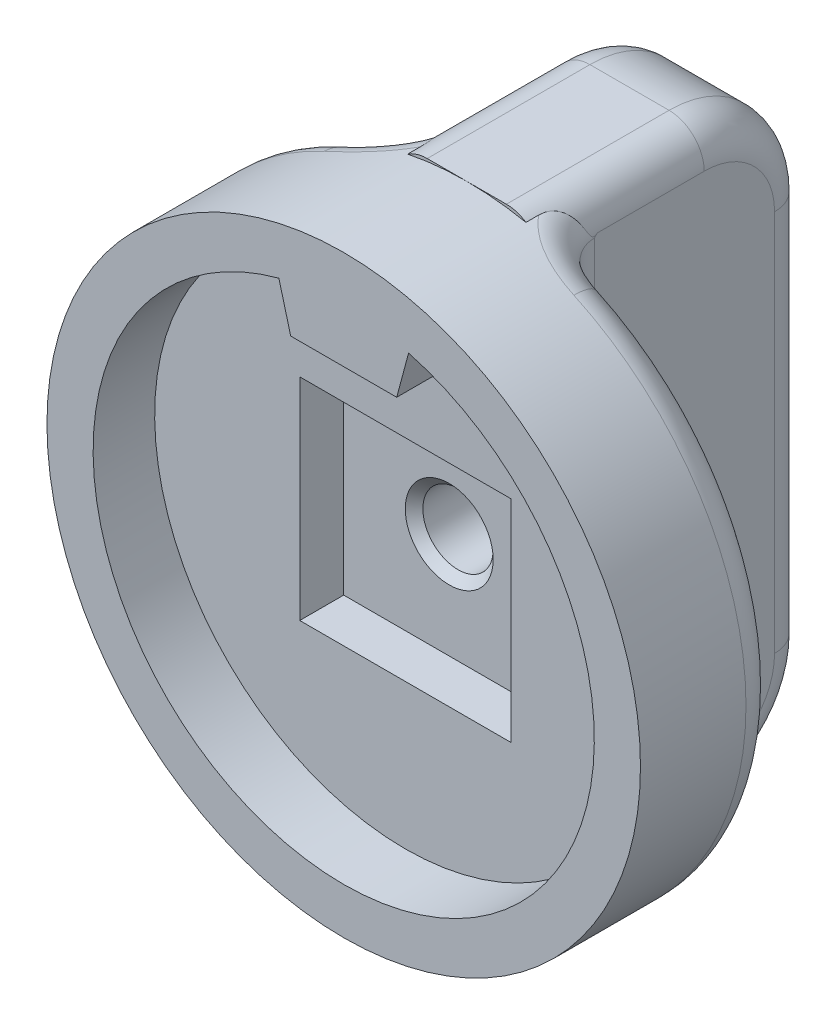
SolidWorks part; units mm, degrees
ref_plane "Plan1" through (0, 0, 0) normal (0, 0, 1) x (1, 0, 0)
ref_plane "Plan2" through (0, 0, 0) normal (0, 1, 0) x (1, 0, 0)
ref_plane "Plan3" through (0, 0, 0) normal (1, 0, 0) x (0, 0, -1)
sketch "Esquisse1" plane through (0, 0, 0) normal (0, 0, 1) x (1, 0, 0)
  circle A0 centre (0, 0) radius 33.75
  dimension "D1" = 67.5
extrude "Base-Extrusion" add sketch "Esquisse1" along normal blind 16
sketch "Esquisse2" plane through (0, 0, 0) normal (1, 0, 0) x (0, 0, -1)
  line L0 (-2, 33.75) -> (16.5, 33.75)
  line L1 (28.5, 21.75) -> (28.5, -21.75)
  line L2 (-2, -33.75) -> (16.5, -33.75)
  line L3 (-2, -33.75) -> (-2, 33.75)
  arc A0 (16.5, 33.75) -> (28.5, 21.75) centre (16.5, 21.75) cw
  arc A1 (16.5, -33.75) -> (28.5, -21.75) centre (16.5, -21.75) ccw
  dimension "D1" = 12
  dimension "D6" = 12
  dimension "D2" = 33.75
  dimension "D3" = 33.75
  dimension "D4" = 28.5
  dimension "D5" = 2
extrude "Boss.-Extru.1" add sketch "Esquisse2" along normal mid plane 17
fillet "Congé3" radius 4 9 edges at (-8.5, 33.206, 2) (-8.5, -33.206, 2) (-8.5, 30.2353, -24.9853) (-8.5, 33.75, -7.25) (-8.5, -33.75, -7.25) (-8.5, -30.2353, -24.9853) (-8.5, 0, -28.5) (-8.5, 32.6621, 1) (-8.5, -32.6621, 1)
fillet "Congé4" radius 4 3 edges at (-8.5, 0, 0) (-8.029, -31.6332, 0) (-8.029, 31.6332, 0)
fillet "Congé5" radius 4 9 edges at (-33.75, 0, 0) (-12.4558, -30.5894, 0) (-12.4558, 30.5894, 0) (-8.029, 31.6332, -4) (-8.029, -31.6332, -4) (-7.3374, 32.9428, -2.5519) (-7.3066, -32.9496, -2.5917) (-9.6716, -29.75, -1.1716) (-9.6716, 29.75, -1.1716)
fillet "Congé9" radius 4 9 edges at (8.5, 33.206, 2) (8.5, 32.6621, 1) (8.5, -32.6621, 1) (8.5, -33.206, 2) (8.5, -33.75, -7.25) (8.5, -30.2353, -24.9853) (8.5, 0, -28.5) (8.5, 30.2353, -24.9853) (8.5, 33.75, -7.25)
fillet "Congé19" radius 4 3 edges at (8.5, 0, 0) (8.029, -31.6332, 0) (8.029, 31.6332, 0)
fillet "Congé20" radius 4 9 edges at (33.75, 0, 0) (12.4558, -30.5894, 0) (12.4558, 30.5894, 0) (8.029, 31.6332, -4) (8.029, -31.6332, -4) (7.3066, 32.9496, -2.5917) (7.3374, -32.9428, -2.5519) (9.6716, -29.75, -1.1716) (9.6716, 29.75, -1.1716)
sketch "Esquisse3" plane through (0, 0, 16) normal (0, 0, 1) x (1, 0, 0)
  line L0 (0, 0) -> (0, 32.3) construction
  line L1 (-7.3763, 27.5289) -> (-6.0289, 22.5)
  line L2 (7.3763, 27.5289) -> (6.0289, 22.5)
  line L3 (-6.0289, 22.5) -> (6.0289, 22.5)
  arc A0 (-7.3763, 27.5289) -> (7.3763, 27.5289) centre (0, 0) ccw
  dimension "D1" = 57
  dimension "D2" = 15
  dimension "D3" = 22.5
extrude "Enlèv. mat.-Extru.1" cut sketch "Esquisse3" against normal blind 7
sketch "Esquisse4" plane through (0, 0, 9) normal (0, 0, 1) x (1, 0, 0)
  line L1 (-12, 12) -> (12, 12)
  line L2 (-12, 12) -> (-12, -12)
  line L3 (-12, -12) -> (12, -12)
  line L4 (12, 12) -> (12, -12)
  dimension "D1" = 12
  dimension "D2" = 24
  dimension "D3" = 12
  dimension "D4" = 24
extrude "Enlèv. mat.-Extru.2" cut sketch "Esquisse4" against normal blind 5
hole_wizard "Perçage1" positions "Esquisse6" profile "Esquisse5" hole size "#0000" standard "Ansi Pouce"
sketch "Esquisse6" plane through (0, 0, 4) normal (0, 0, 1) x (1, 0, 0)
  point P0 (0, 0)
sketch "Esquisse5" plane through (0, 0, 4) normal (1, 0, 0) x (0, -1, 0)
  line L0 (0, 0) -> (0, 24.9034)
  line L1 (0, 24.9034) -> (4, 22.5)
  line L2 (4, 22.5) -> (4, 0)
  line L5 (4, 0) -> (0, 0)
  line L10 (0, 24.9034) -> (-4, 22.5) construction
  line L11 (0, -6.35) -> (0, 107.95) construction
  dimension "Diamètre du perçage" = 8
  dimension "Profondeur du perçage" = 22.5
  dimension "Angle de pointe" = 118
chamfer "Chanfrein1" distance 1 angle 45 1 edges at (4, 0, 4)
